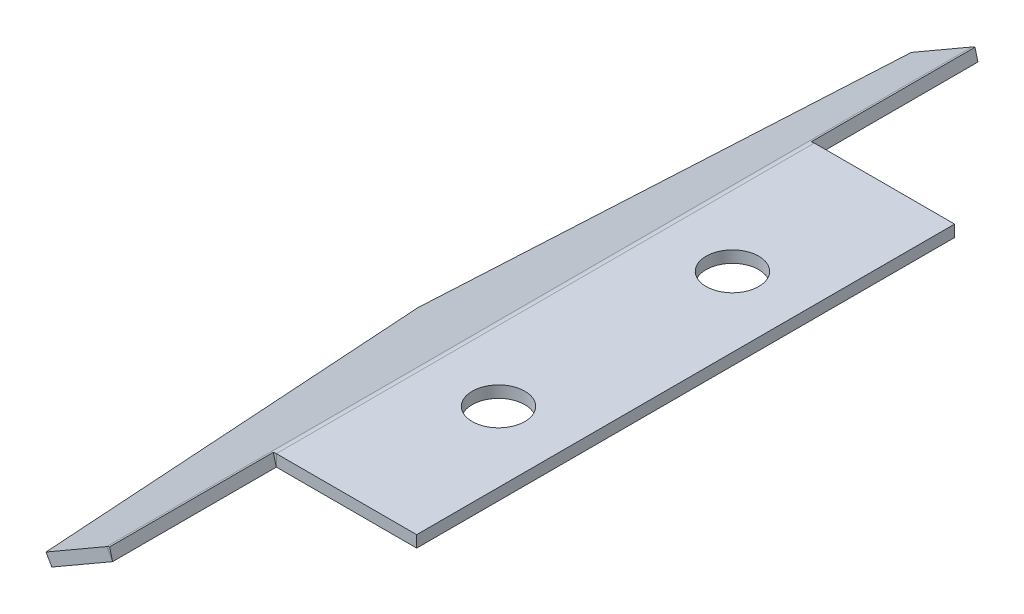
SolidWorks part; units mm, degrees
ref_plane "Front Plane" through (0, 0, 0) normal (0, 0, 1) x (1, 0, 0)
ref_plane "Top Plane" through (0, 0, 0) normal (0, 1, 0) x (1, 0, 0)
ref_plane "Right Plane" through (0, 0, 0) normal (1, 0, 0) x (0, 0, -1)
sketch "Sketch1" plane through (0, 0, 0) normal (0, 1, 0) x (1, 0, 0)
  line L0 (0, 0) -> (24, 0) construction
  line L1 (24, -23) -> (24, 23)
  line L2 (24, 23) -> (12, 23)
  line L3 (12, 23) -> (12, 37)
  line L4 (12, 37) -> (6, 37)
  line L5 (6, 37) -> (0, 0)
  line L6 (6, -37) -> (0, 0)
  line L7 (12, -37) -> (6, -37)
  line L8 (12, -23) -> (12, -37)
  line L9 (24, -23) -> (12, -23)
  circle A0 centre (18, 10) radius 2.25
  circle A1 centre (18, -10) radius 2.25
  dimension "D2" = 4.5
  dimension "D3" = 6
  dimension "D4" = 6
  dimension "D7" = 10
  dimension "D1" = 24
  dimension "D5" = 6
  dimension "D6" = 6
  dimension "D8" = 23
  dimension "D9" = 37
sheet metal parameters "Sheet-Metal1" thickness 1 parameters "D1"=0.0001
base flange "Base-Flange1" sketch "Sketch1" thickness 1 reverse thickness direction yes parameters "D1"=0.0001
sketch "Sketch3" plane through (0, 1, 0) normal (0, 1, 0) x (1, 0, 0)
  line L0 (12, 23) -> (12, -23)
sketched bend "Sketched Bend7" parameters "D1"=0.001
bend "SketchBend7" bend radius 0.001 bend angle 30 parameters "D5"=1
flat pattern "Flat-Pattern1"
sketch "Bend-Lines1" plane through (0, 0, 0) normal (0, 1, 0) x (-1, 0, 0)
bend of the flat pattern "Flatten-<SketchBend7>1"
